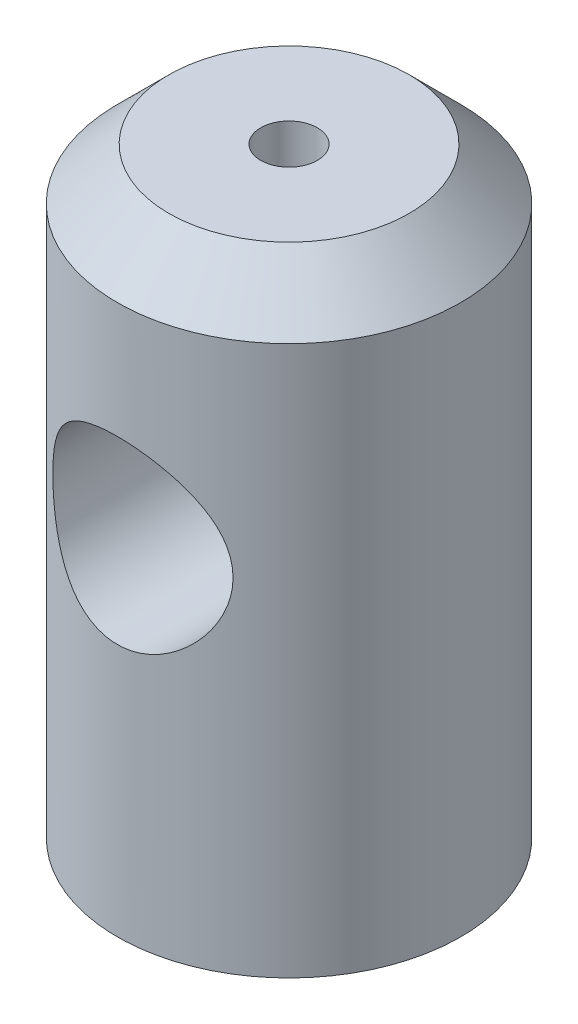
SolidWorks part; units mm, degrees
ref_plane "Front Plane" through (0, 0, 0) normal (0, 0, 1) x (1, 0, 0)
ref_plane "Top Plane" through (0, 0, 0) normal (0, 1, 0) x (1, 0, 0)
ref_plane "Right Plane" through (0, 0, 0) normal (1, 0, 0) x (0, 0, -1)
sketch "Sketch1" plane through (0, 0, 0) normal (0, 0, 1) x (1, 0, 0)
  line L0 (7, 35) -> (10, 32)
  line L1 (0, 0) -> (10, 0)
  line L2 (0, 0) -> (0, 35)
  line L3 (0, 35) -> (7, 35)
  line L4 (10, 0) -> (10, 32)
  point P1 (10, 35)
  dimension "D1" = 35
  dimension "D2" = 10
revolve "Revolve1" add sketch "Sketch1" angle 360 about L2
hole_wizard "M4 Tapped Hole1" positions "3DSketch1" profile "Sketch2" tap size "M4" standard "ISO"
sketch3d "3DSketch1"
  line L0 (0, 32, 0) -> (0, 35, 0) construction
  point P0 (0, 35, 0)
sketch "Sketch2" plane through (0, 35, 0) normal (1, 0, 0) x (0, 0, 1)
  line L0 (0, 0) -> (0, 35)
  line L1 (0, 35) -> (1.65, 35)
  line L2 (1.65, 35) -> (1.65, 0)
  line L5 (1.65, 0) -> (0, 0)
  line L11 (0, -6.35) -> (0, 107.95) construction
  dimension "Thru Tap Drill Dia." = 3.3
  dimension "Thru Tap Drill Depth" = 35
sketch "Sketch3" plane through (0, 0, 0) normal (0, 0, 1) x (1, 0, 0)
  line L0 (0, 35) -> (0, 0) construction
  line L1 (7, 35) -> (-7, 35) construction
  circle A0 centre (0, 20) radius 5.25
  dimension "D1" = 10.5
  dimension "D2" = 15
extrude "Extrude1" cut sketch "Sketch3" against normal mid plane 40
